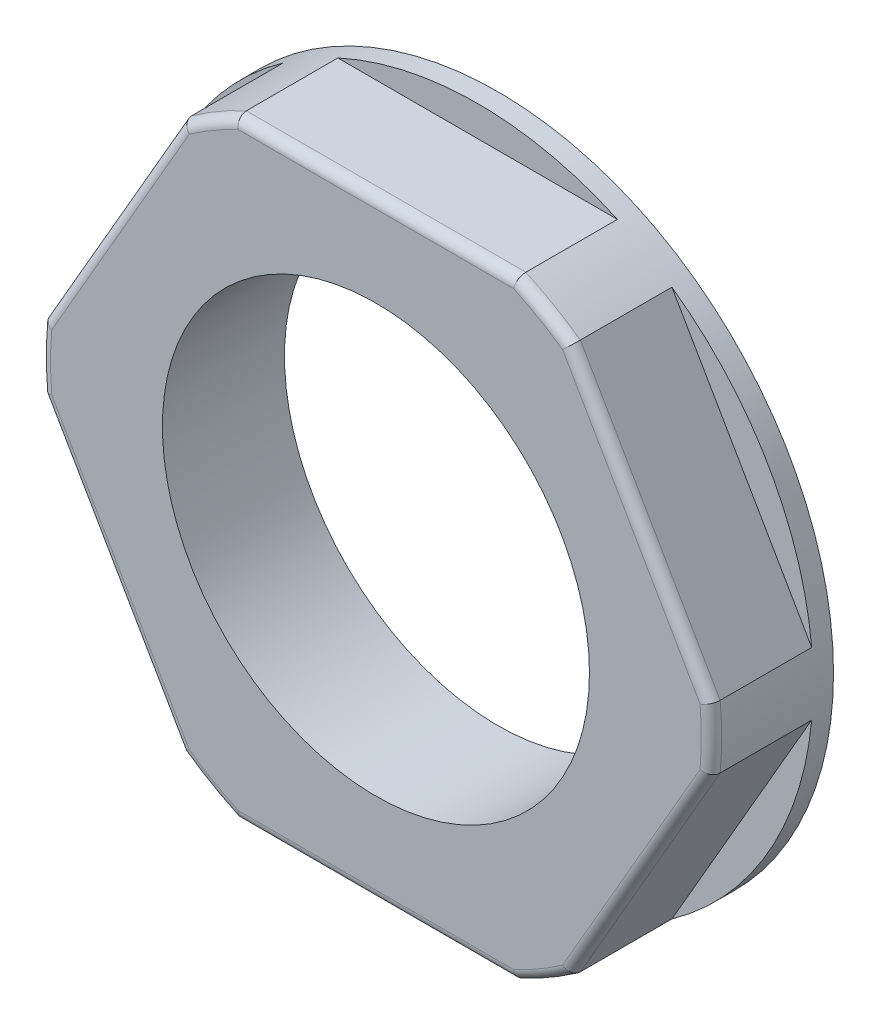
SolidWorks part; units mm, degrees
ref_plane "Plan1" through (0, 0, 0) normal (0, 0, 1) x (1, 0, 0)
ref_plane "Plan2" through (0, 0, 0) normal (0, 1, 0) x (1, 0, 0)
ref_plane "Plan3" through (0, 0, 0) normal (1, 0, 0) x (0, 0, -1)
sketch "Esquisse1" plane through (0, 0, 0) normal (0, 0, 1) x (1, 0, 0)
  circle A0 centre (0, 0) radius 10.5
  circle A1 centre (0, 0) radius 16.5
  dimension "D1" = 21
  dimension "D2" = 33
extrude "Base-Extrusion" add sketch "Esquisse1" along normal blind 6
sketch "Esquisse2" plane through (0, 0, 6) normal (0, 0, 1) x (1, 0, 0)
  line L0 (-22.357, 0) -> (22.357, 0) construction
  line L1 (8.6603, 15) -> (-8.6603, 15)
  line L2 (-8.6603, 15) -> (-17.3205, 0)
  line L3 (-17.3205, 0) -> (-8.6603, -15)
  line L4 (-8.6603, -15) -> (8.6603, -15)
  line L5 (8.6603, -15) -> (17.3205, 0)
  line L6 (17.3205, 0) -> (8.6603, 15)
  circle A0 centre (0, 0) radius 15 construction
  circle A1 centre (0, 0) radius 20
  dimension "D2" = 40
  dimension "D1" = 30
extrude "Enlèv. mat.-Extru.1" cut sketch "Esquisse2" against normal blind 5
fillet "Congé1" radius 0.5
